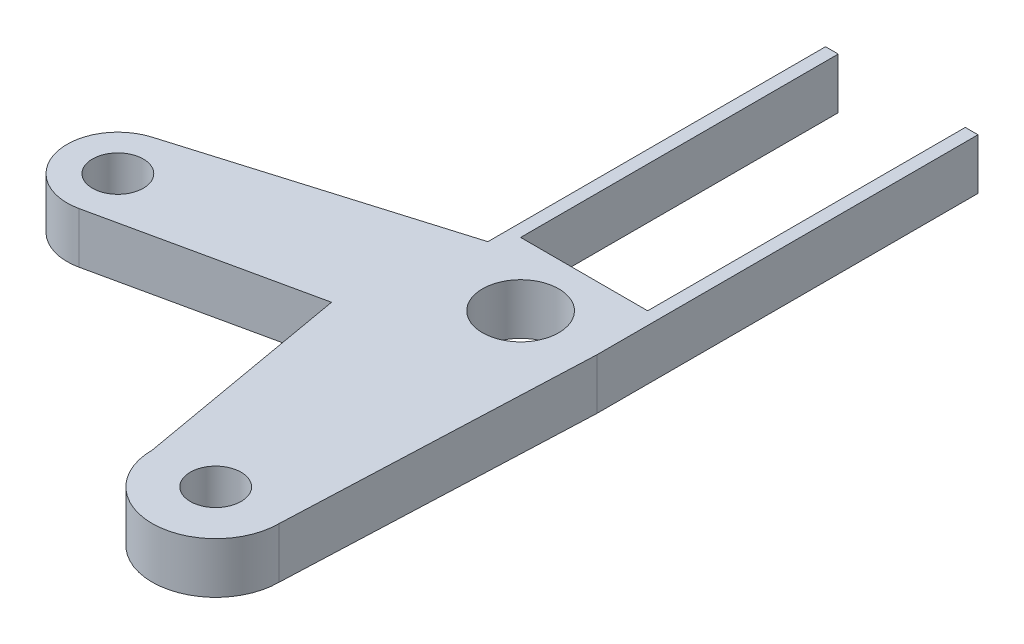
SolidWorks part; units mm, degrees
ref_plane "Vorderseite" through (0, 0, 0) normal (0, 0, 1) x (1, 0, 0)
ref_plane "Oben" through (0, 0, 0) normal (0, 1, 0) x (1, 0, 0)
ref_plane "Rechts" through (0, 0, 0) normal (1, 0, 0) x (0, 0, -1)
ref_plane "Ebene1" through (0, 340, 0) normal (0, 1, 0) x (1, 0, 0)
sketch "Skizze1" plane through (0, 340, 340) normal (0, 1, 0) x (1, 0, 0)
  line L1 (-530, -120) -> (-452, -120)
  line L3 (0, 0) -> (0, 2902.3)
  line L4 (0, 0) -> (0, -120)
  line L5 (0, -120) -> (0, -32.5)
  line L6 (0, -32.5) -> (-126, -32.5)
  line L7 (-530, 0) -> (530, 0) construction
  line L8 (530, 150) -> (530, -150)
  line L9 (-530, 150) -> (-530, -150)
  line L10 (530, -120) -> (452, -120)
  line L11 (-452, -120) -> (0, -120)
  line L12 (0, -120) -> (452, -120)
  line L13 (-530, -1040) -> (530, -1040) construction
  line L14 (0, 0) -> (0, -1040) construction
  line L15 (529.9542, -890) -> (530.0458, -1190)
  line L16 (-530.0526, -867.5292) -> (-529.9474, -1212.4708)
  line L17 (-530.0366, -920) -> (-452.0366, -919.9762)
  line L18 (529.9634, -920) -> (451.9634, -920.0238)
  line L19 (-0.0366, -920) -> (0, -1040)
  line L20 (-0.0099, -1007.5) -> (125.9901, -1007.4615)
  line L21 (-126, -32.5) -> (125.9901, -1007.4615)
  line L22 (-452.0366, -919.9762) -> (-0.0366, -920)
  line L23 (-0.0366, -920) -> (451.9634, -920.0238)
  line L24 (0, -1356) -> (0, -1040)
  line L25 (344.7172, -520) -> (0, -520)
  circle A0 centre (0, 0) radius 7.3181
  point P4 (0, 0)
  point P13 (0, 0)
  point P17 (-530, 0)
  point P19 (530, 0)
  point P30 (-530, -1040)
  point P31 (530, -1040)
  dimension "D3" = 2902.3
  dimension "D5" = 32.5
  dimension "D6" = 120
  dimension "D7" = 1060
  dimension "D8" = 78
  dimension "D9" = 120
  dimension "D10" = 120
  dimension "D11" = 452
  dimension "D14" = 300
  dimension "D15" = 1040
  dimension "D16" = 126
  dimension "D17" = 120
  dimension "D18" = 120
  dimension "D19" = 32.5
  dimension "D20" = 1007
  dimension "D21" = 316
ref_plane "Ebene2" through (0, 360, 0) normal (0, 1, 0) x (1, 0, 0)
sketch "Skizze2" plane through (0, 360, 0) normal (0, 1, 0) x (1, 0, 0)
  line L0 (-131.7357, -353.3401) -> (-30, -322.8846)
  line L1 (-121.7526, -392.0438) -> (-40.1111, -374.3008)
  line L2 (30, -340) -> (25, -460)
  line L3 (25, -340) -> (25, -460) construction
  line L4 (-25, -460) -> (-40.1111, -374.3008)
  line L6 (-30, -322.8846) -> (-30, -190)
  line L7 (-30, -190) -> (-25, -190)
  line L8 (-25, -315) -> (-25, -190)
  line L9 (25, -190) -> (30, -190)
  line L10 (25, -190) -> (25, -315)
  line L12 (30, -190) -> (30, -340)
  line L13 (-25, -315) -> (25, -315)
  circle A0 centre (0, -340) radius 15
  circle A1 centre (-126, -372.5) radius 10
  circle A2 centre (0, -460) radius 10
  arc A4 (-131.7357, -353.3401) -> (-121.7526, -392.0438) centre (-126, -372.5) ccw
  arc A5 (-25, -460) -> (25, -460) centre (0, -460) ccw
  dimension "D1" = 30
  dimension "D3" = 20
  dimension "D4" = 40
  dimension "D5" = 20
  dimension "D6" = 50
  dimension "D7" = 5
  dimension "D8" = 5
  dimension "D9" = 150
  dimension "D10" = 30
  dimension "D12" = 30
  dimension "D13" = 10
extrude "Aufsatz-Linear austragen1" add sketch "Skizze2" along normal blind 20 contours L0 L6 L7 L8 L13 L10 L9 L12 L2 A5 L4 L1 A4 | A0 | A1 | A2
